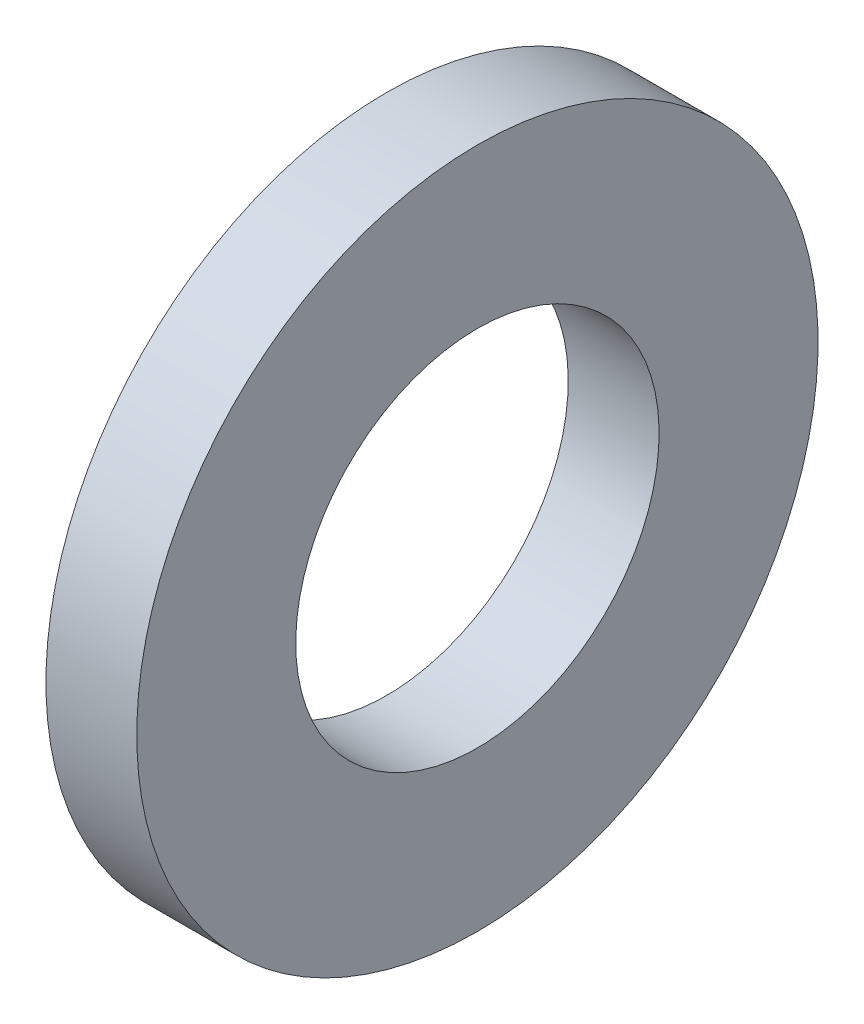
SolidWorks part; units mm, degrees
ref_plane "Face" through (0, 0, 0) normal (0, 0, 1) x (1, 0, 0)
ref_plane "Dessus" through (0, 0, 0) normal (0, 1, 0) x (1, 0, 0)
ref_plane "Droite" through (0, 0, 0) normal (1, 0, 0) x (0, 0, -1)
ref_plane "Plan1" through (0, 0, 0) normal (0, 0, 1) x (1, 0, 0)
sketch "Esquisse1" plane through (0, 0, 0) normal (0, 0, 1) x (1, 0, 0)
  line L0 (0, 6) -> (0, 3.2)
  line L1 (0, 3.2) -> (1.6, 3.2)
  line L2 (1.6, 3.2) -> (1.6, 6)
  line L3 (1.6, 6) -> (0, 6)
  line L4 (1.6, 0) -> (0, 0) construction
revolve "Révolution1" add sketch "Esquisse1" angle 360 about L4
